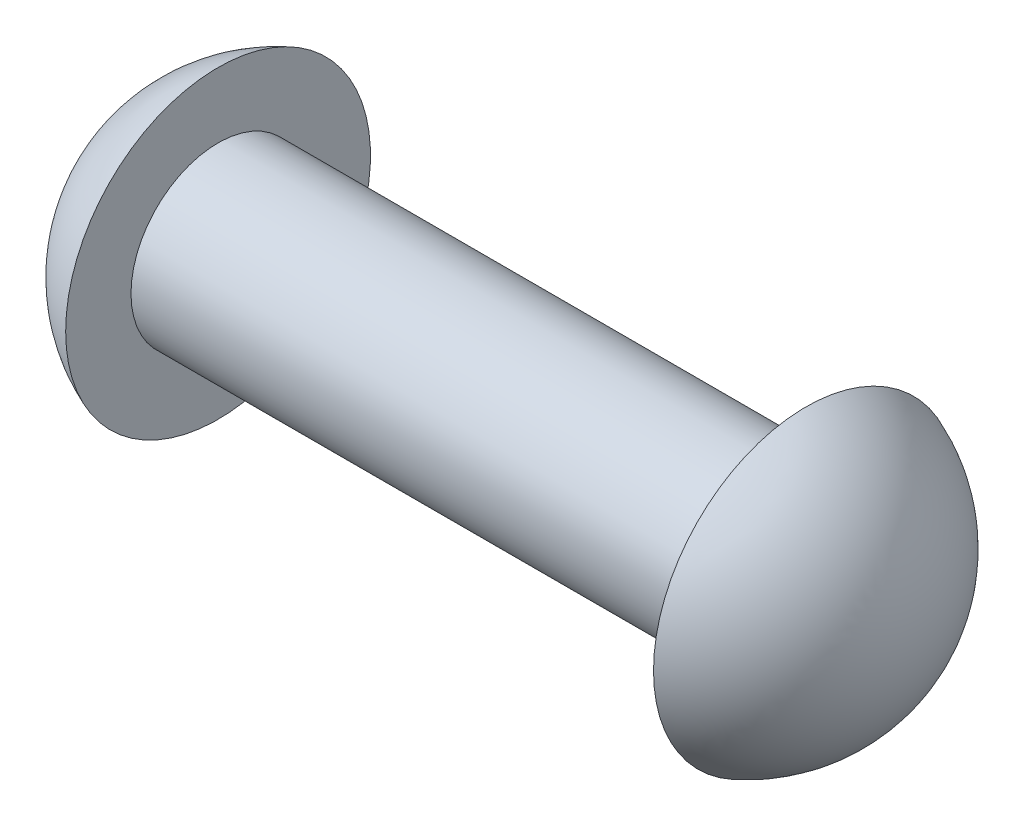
SolidWorks part; units mm, degrees
ref_plane "Plane1" through (0, 0, 0) normal (0, 0, 1) x (1, 0, 0)
ref_plane "Plane2" through (0, 0, 0) normal (0, 1, 0) x (1, 0, 0)
ref_plane "Plane3" through (0, 0, 0) normal (1, 0, 0) x (0, 0, -1)
sketch "Sketch1" plane through (0, 0, 0) normal (0, 0, 1) x (1, 0, 0)
  line L0 (-39, 0) -> (6, 0) construction
  line L1 (-31.8, 0) -> (0, 0)
  line L2 (-27, 4) -> (-27, 7)
  line L3 (-27, 4) -> (0, 4)
  line L4 (0, 4) -> (0, 0)
  arc A0 (-27, 7) -> (-31.8, 0) centre (-24.3, 0.0029) ccw
  point P12 (-27, 4)
  dimension "HeadRadius" = 7.5
  dimension "Diameter" = 8
  dimension "GripLength" = 27
  dimension "HeadHt" = 4.8
  dimension "HeadDia" = 14
revolve "Base-Revolve" add sketch "Sketch1" angle 360 about L0
sketch "Sketch3" plane through (0, 0, 0) normal (0, 0, 1) x (1, 0, 0)
  line L0 (-49, 0) -> (71, 0) construction
  line L1 (0, 0) -> (4.8, 0)
  line L2 (0, 0) -> (0, 7)
  arc A0 (4.8, 0) -> (0, 7) centre (-2.7, 0.0029) ccw
  dimension "D1" = 14
  dimension "D3" = 7.5
  dimension "D2" = 4.8
revolve "HeadTypeA" add sketch "Sketch3" angle 360 about L0
sketch "Sketch4" plane through (0, 0, 0) normal (0, 0, 1) x (1, 0, 0)
  line L0 (30, 0) -> (-54, 0) construction
  line L1 (-39, 0) -> (6, 0) construction
  line L2 (0, 0) -> (0, 7)
  line L3 (0, 7) -> (-3.9097, 4)
  line L4 (-3.9097, 0) -> (0, 0)
  line L5 (0, -7) -> (-3.9097, -4) construction
  line L6 (-3.9097, 0) -> (-3.9097, 4)
  dimension "D1" = 14
  dimension "D2" = 75
  dimension "D3" = 8
revolve "HeadTypeB" [suppressed] add sketch "Sketch4" angle 360 about L0
equation "\"D1@Sketch3\" = \"HeadDia@Sketch1\""
equation "\"D2@Sketch3\" = \"HeadHt@Sketch1\""
equation "\"D3@Sketch3\" = \"HeadRadius@Sketch1\""
equation "\"D1@Sketch4\" = \"HeadDia@Sketch1\""
equation "\"D3@Sketch4\" = \"Diameter@Sketch1\""
